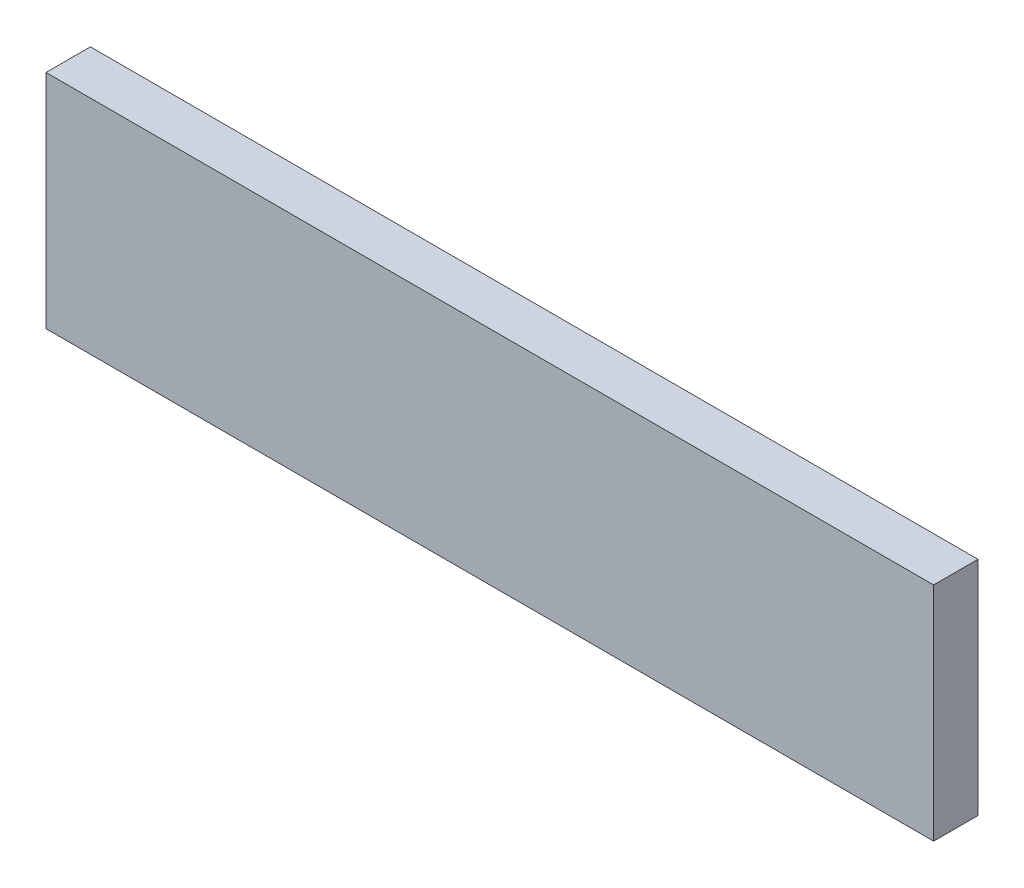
SolidWorks part; units mm, degrees
ref_plane "Plan de face" through (0, 0, 0) normal (0, 0, 1) x (1, 0, 0)
ref_plane "Plan de dessus" through (0, 0, 0) normal (0, 1, 0) x (1, 0, 0)
ref_plane "Plan de droite" through (0, 0, 0) normal (1, 0, 0) x (0, 0, -1)
sketch "Esquisse1" plane through (0, 0, 0) normal (0, 0, 1) x (1, 0, 0)
  line L1 (0, 0) -> (200, 0)
  line L2 (0, 0) -> (0, 50)
  line L3 (0, 50) -> (200, 50)
  line L4 (200, 0) -> (200, 50)
  dimension "D1" = 200
  dimension "D2" = 50
extrude "Extrusion1" add sketch "Esquisse1" along normal blind 10
